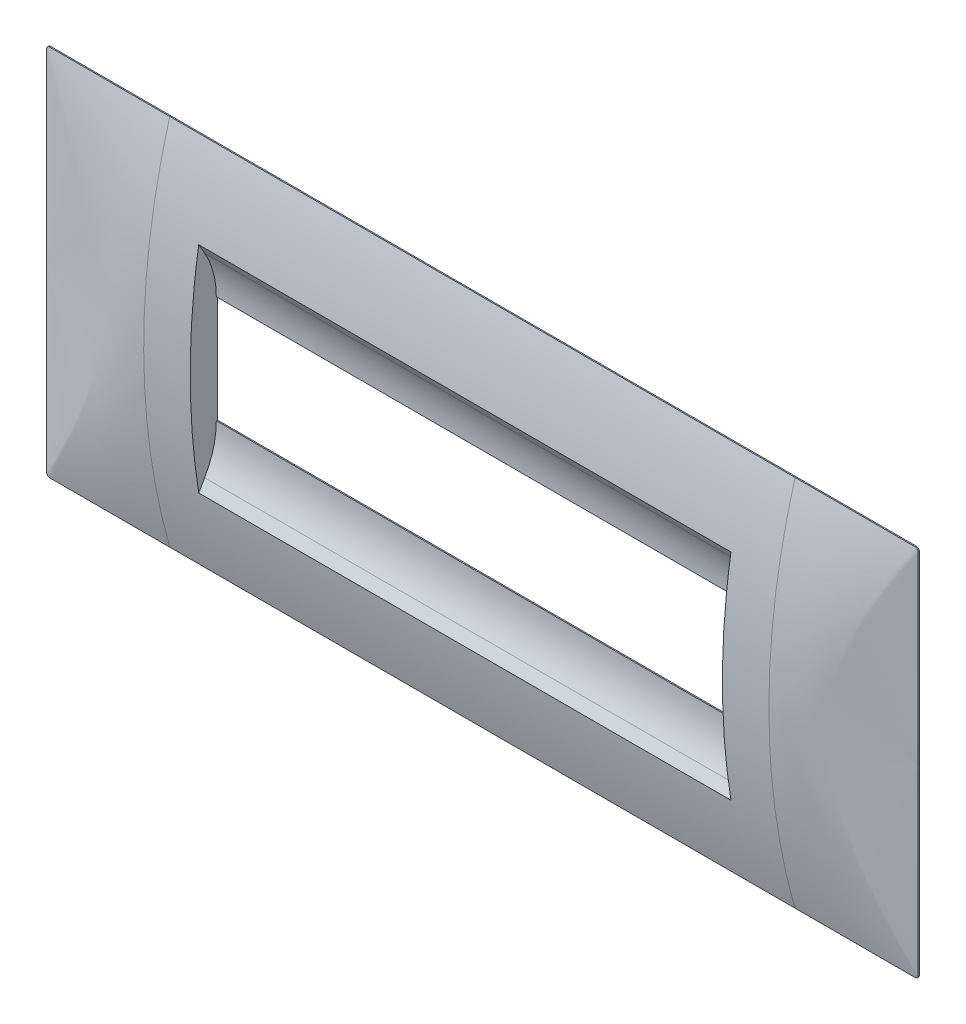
SolidWorks part; units mm, degrees
ref_plane "Vorne" through (0, 0, 0) normal (0, 0, 1) x (1, 0, 0)
ref_plane "Oben" through (0, 0, 0) normal (0, 1, 0) x (1, 0, 0)
ref_plane "Rechts" through (0, 0, 0) normal (1, 0, 0) x (0, 0, -1)
sketch "Skizze1" plane through (0, 0, 0) normal (0, 0, 1) x (1, 0, 0)
  line L0 (750, 0) -> (538, 0) construction
  line L1 (538, 321) -> (750, 321)
  line L2 (538, 321) -> (538, -321)
  line L3 (538, -321) -> (750, -321)
  line L4 (750, 321) -> (750, -321)
  dimension "D1" = 642
  dimension "D2" = 750
  dimension "D3" = 212
ref_plane "Ebene1" through (750, 0, 0) normal (1, 0, 0) x (0, 0, -1)
ref_plane "Ebene2" through (538, 0, 0) normal (1, 0, 0) x (0, 0, -1)
sketch "Skizze2" plane through (538, 0, 0) normal (1, 0, 0) x (0, 0, -1)
  line L1 (0, 321) -> (0, -321) construction
  line L2 (0, 0) -> (-104.1864, 0) construction
  line L3 (0, -321) -> (0, 321)
  arc A0 (0, 321) -> (0, -321) centre (1122.4, 0) ccw
  dimension "D1" = 321
  dimension "D2" = 45
sketch "Skizze3" plane through (0, 0, 0) normal (0, 0, 1) x (1, 0, 0)
  line L0 (750, 321) -> (750, -321) construction
  point P0 (750, 0)
sketch "Skizze7" plane through (0, 0, 0) normal (0, 0, 1) x (1, 0, 0)
  line L0 (538, 321) -> (745, 321)
  line L1 (750, 316) -> (750, 0)
  arc A0 (745, 321) -> (750, 316) centre (745, 316) cw
  point P8 (750, 321)
  dimension "D1" = 5
sketch "Skizze8" plane through (0, 0, 0) normal (0, 0, 1) x (1, 0, 0)
  line L0 (538, -321) -> (745, -321)
  line L1 (750, -316) -> (750, 0)
  arc A0 (745, -321) -> (750, -316) centre (745, -316) ccw
  point P8 (750, -321)
  dimension "D1" = 5
sketch "Skizze6" plane through (0, 0, 0) normal (0, 1, 0) x (1, 0, 0)
  line L0 (538, 0) -> (538, -45) construction
  line L1 (538, 0) -> (750, 0) construction
  line L2 (538, -45) -> (538, 0) construction
  line L3 (538, 0) -> (538, -104.1864) construction
  line L4 (538, 0) -> (750, 0) construction
  line L5 (750, 0) -> (613.1999, -35.4221)
  arc A0 (538, -45) -> (613.1999, -35.4221) centre (538, 255) ccw
  dimension "D2" = 300
  dimension "D1" = 45
loft "Ausformung5" add profiles "Skizze2", "Skizze3"
sketch "Skizze11" plane through (0, 0, 0) normal (0, 0, -1) x (-1, 0, 0)
  line L1 (-538, -321) -> (-538, 321)
  line L2 (-538, -321) -> (-538, 321)
  point P3 (-750, 0)
  dimension "D1" = 0
extrude "Linear austragen2" add sketch "Skizze11" along normal blind 2
sketch "Skizze12" plane through (538, 0, 0) normal (-1, 0, 0) x (0, 0, 1)
  line L3 (0, 321) -> (-2, 321)
  line L4 (-2, 321) -> (-2, -321)
  line L5 (-2, -321) -> (0, -321)
  line L6 (0, 321) -> (-2, 321)
  line L7 (-2, 321) -> (-2, -321)
  line L8 (-2, -321) -> (0, -321)
  dimension "D1" = 0
extrude "Linear austragen3" add sketch "Skizze12" along normal blind 1076
mirror "Spiegeln1" about plane through (0, 0, 0) normal (1, 0, 0) of "Linear austragen2", "Ausformung5"
ref_plane "Ebene3" through (0, 0, 50) normal (0, 0, 1) x (1, 0, 0)
sketch "Skizze16" plane through (0, 0, 0) normal (1, 0, 0) x (0, 0, -1)
  line L0 (-84.5358, 185) -> (32.8495, 185) construction
  line L1 (-30.2481, 185) -> (-20.0962, 167.4163)
  line L2 (0, 0) -> (0, 321) construction
  line L3 (-150, 92.4163) -> (22.8849, 92.4163) construction
  line L4 (-30.2481, 185) -> (-60.8786, 185)
  line L5 (-60.8786, 185) -> (-60.8786, -185)
  line L6 (0, 0) -> (-78.9285, 0) construction
  line L8 (0, 92.4163) -> (15.8645, 92.4163)
  line L9 (15.8645, 92.4163) -> (15.8645, -92.4163)
  line L10 (-30.2481, -185) -> (-60.8786, -185)
  line L11 (-30.2481, -185) -> (-20.0962, -167.4163)
  line L12 (0, -92.4163) -> (15.8645, -92.4163)
  arc A0 (0, 92.4163) -> (-20.0962, 167.4163) centre (-150, 92.4163) ccw
  arc A1 (0, -92.4163) -> (-20.0962, -167.4163) centre (-150, -92.4163) cw
  point P5 (0, -321)
  point P6 (0, 321)
  point P23 (-60.8786, 0)
  point P25 (15.8645, 0)
  dimension "D3" = 300
  dimension "D1" = 185
  dimension "D2" = 60
extrude "Schnitt-Linear austragen2" cut sketch "Skizze16" against normal mid plane 916
